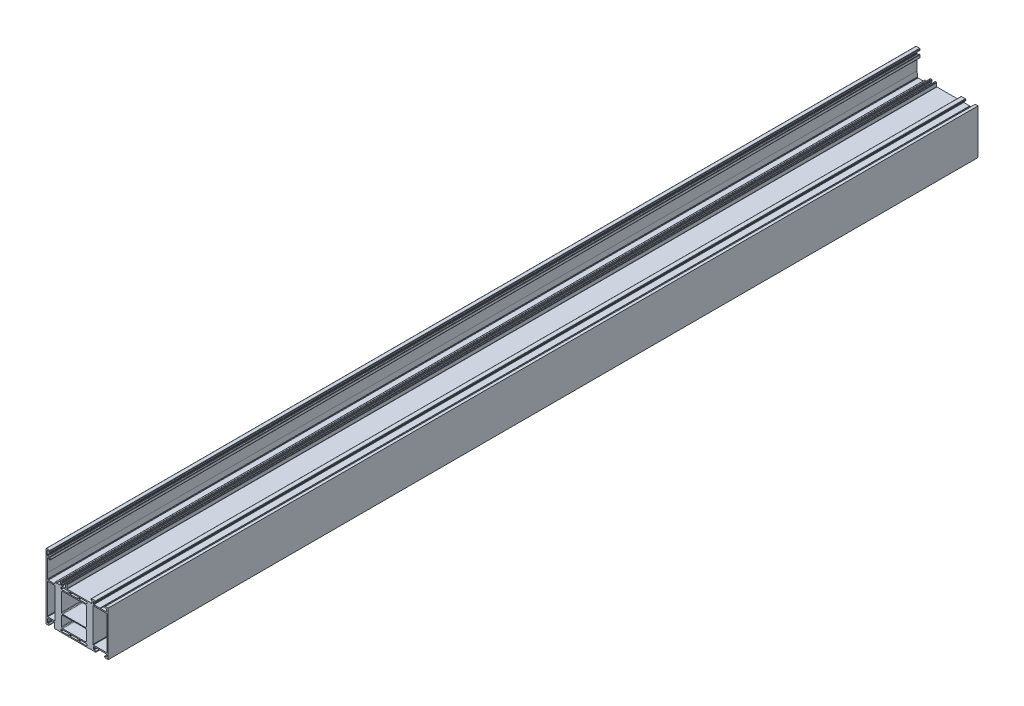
SolidWorks part; units mm, degrees
ref_plane "Ebene vorne" through (0, 0, 0) normal (0, 0, 1) x (1, 0, 0)
ref_plane "Ebene oben" through (0, 0, 0) normal (0, 1, 0) x (1, 0, 0)
ref_plane "Ebene rechts" through (0, 0, 0) normal (1, 0, 0) x (0, 0, -1)
sketch "Skizze1" plane through (0, 0, 0) normal (0, 0, 1) x (1, 0, 0)
  line L0 (15.4, 49) -> (16.2002, 49.0012)
  line L5 (1.85, 45.533) -> (1.9706, 45.583)
  line L6 (28.9408, 47.4176) -> (28.9038, 47.3119)
  line L7 (25.3003, 49.0607) -> (25.3415, 49.0285)
  line L8 (25.3415, 49.0285) -> (25.3896, 49.0079)
  line L9 (25.3896, 49.0079) -> (25.4414, 49.0001)
  line L10 (18.5413, 47.7007) -> (18.43, 47.6881)
  line L11 (47.2413, 44.1006) -> (20.2413, 44.1006)
  line L12 (20.2413, 44.1006) -> (19.9075, 44.063)
  line L13 (19.9075, 44.063) -> (19.5905, 43.9521)
  line L14 (19.5905, 43.9521) -> (19.3061, 43.7734)
  line L15 (19.3061, 43.7734) -> (19.0685, 43.5359)
  line L16 (19.0685, 43.5359) -> (18.8898, 43.2515)
  line L17 (18.8898, 43.2515) -> (18.7789, 42.9344)
  line L18 (18.7789, 42.9344) -> (18.7413, 42.6006)
  line L19 (18.7413, 42.6006) -> (18.7413, 21.6006)
  line L20 (1.6, 27) -> (1.6, 8.9)
  line L21 (1.6, 8.9) -> (1.6125, 8.7888)
  line L22 (1.6125, 8.7888) -> (1.6495, 8.6831)
  line L23 (1.6495, 8.6831) -> (1.7091, 8.5883)
  line L24 (1.7091, 8.5883) -> (1.7883, 8.5091)
  line L25 (1.7883, 8.5091) -> (1.8831, 8.4495)
  line L26 (1.8831, 8.4495) -> (1.9887, 8.4125)
  line L27 (1.9887, 8.4125) -> (2.1, 8.4)
  line L28 (2.1, 8.4) -> (10.3, 8.4)
  line L29 (10.3, 8.4) -> (10.4113, 8.4125)
  line L30 (10.4113, 8.4125) -> (10.5169, 8.4495)
  line L31 (10.5169, 8.4495) -> (10.6117, 8.5091)
  line L32 (10.6117, 8.5091) -> (10.6909, 8.5883)
  line L33 (10.6909, 8.5883) -> (10.7505, 8.6831)
  line L34 (10.7505, 8.6831) -> (10.7875, 8.7888)
  line L35 (10.7875, 8.7888) -> (10.8, 8.9)
  line L36 (10.8, 8.9) -> (10.8, 45.1)
  line L37 (10.8, 45.1) -> (10.7875, 45.2113)
  line L38 (10.7875, 45.2113) -> (10.7505, 45.317)
  line L39 (10.7505, 45.317) -> (10.6909, 45.4118)
  line L40 (10.6909, 45.4118) -> (10.6117, 45.4909)
  line L41 (10.6117, 45.4909) -> (10.5169, 45.5505)
  line L42 (10.5169, 45.5505) -> (10.4113, 45.5875)
  line L43 (10.4113, 45.5875) -> (10.3, 45.6)
  line L44 (10.3, 45.6) -> (2.1, 45.6)
  line L45 (2.1, 45.6) -> (1.9706, 45.583)
  line L46 (1.9706, 45.583) -> (1.85, 45.533)
  line L47 (1.85, 45.533) -> (1.7465, 45.4536)
  line L48 (1.7465, 45.4536) -> (1.667, 45.35)
  line L49 (1.667, 45.35) -> (1.617, 45.2294)
  line L50 (1.617, 45.2294) -> (1.6, 45.1)
  line L51 (1.6, 45.1) -> (1.6, 27)
  line L52 (0, 0) -> (0, 39.25)
  line L53 (0, 39.25) -> (0, 78.5)
  line L54 (0, 78.5) -> (0.0125, 78.6113)
  line L55 (0.0125, 78.6113) -> (0.0495, 78.7169)
  line L56 (0.0495, 78.7169) -> (0.1091, 78.8117)
  line L57 (0.1091, 78.8117) -> (0.1883, 78.8909)
  line L58 (0.1883, 78.8909) -> (0.2831, 78.9505)
  line L59 (0.2831, 78.9505) -> (0.3887, 78.9875)
  line L60 (0.3887, 78.9875) -> (0.5, 79)
  line L61 (0.5, 79) -> (4.5, 79)
  line L62 (4.5, 79) -> (4.6113, 78.9875)
  line L63 (4.6113, 78.9875) -> (4.7169, 78.9505)
  line L64 (4.7169, 78.9505) -> (4.8117, 78.8909)
  line L65 (4.8117, 78.8909) -> (4.8909, 78.8117)
  line L66 (4.8909, 78.8117) -> (4.9505, 78.7169)
  line L67 (4.9505, 78.7169) -> (4.9875, 78.6113)
  line L68 (4.9875, 78.6113) -> (5, 78.5)
  line L69 (5, 78.5) -> (5, 77.2)
  line L70 (5, 77.2) -> (4.9875, 77.0887)
  line L71 (4.9875, 77.0887) -> (4.9505, 76.983)
  line L72 (4.9505, 76.983) -> (4.8909, 76.8882)
  line L73 (4.8909, 76.8882) -> (4.8117, 76.8091)
  line L74 (4.8117, 76.8091) -> (4.7169, 76.7495)
  line L75 (4.7169, 76.7495) -> (4.6113, 76.7125)
  line L76 (4.6113, 76.7125) -> (4.5, 76.7)
  line L77 (4.5, 76.7) -> (4, 76.7)
  line L78 (4, 76.7) -> (4, 77.7)
  line L79 (4, 77.7) -> (2.3, 77.7)
  line L80 (2.3, 77.7) -> (2.0412, 77.6659)
  line L81 (2.0412, 77.6659) -> (1.8, 77.566)
  line L82 (1.8, 77.566) -> (1.5929, 77.4071)
  line L83 (1.5929, 77.4071) -> (1.434, 77.2)
  line L84 (1.434, 77.2) -> (1.3341, 76.9588)
  line L85 (1.3341, 76.9588) -> (1.3, 76.7)
  line L86 (1.3, 76.7) -> (1.3, 72.7)
  line L87 (1.3, 72.7) -> (1.3251, 72.4775)
  line L88 (1.3251, 72.4775) -> (1.399, 72.2661)
  line L89 (1.399, 72.2661) -> (1.5182, 72.0765)
  line L90 (1.5182, 72.0765) -> (1.6765, 71.9182)
  line L91 (1.6765, 71.9182) -> (1.8661, 71.799)
  line L92 (1.8661, 71.799) -> (2.0775, 71.7251)
  line L93 (2.0775, 71.7251) -> (2.3, 71.7)
  line L94 (2.3, 71.7) -> (4, 71.7)
  line L95 (4, 71.7) -> (4, 72.7)
  line L96 (4, 72.7) -> (4.5, 72.7)
  line L97 (4.5, 72.7) -> (4.6294, 72.683)
  line L98 (4.6294, 72.683) -> (4.75, 72.633)
  line L99 (4.75, 72.633) -> (4.8535, 72.5536)
  line L100 (4.8535, 72.5536) -> (4.933, 72.45)
  line L101 (4.933, 72.45) -> (4.983, 72.3294)
  line L102 (4.983, 72.3294) -> (5, 72.2)
  line L103 (5, 72.2) -> (5, 69.4)
  line L104 (5, 69.4) -> (4.9875, 69.2887)
  line L105 (4.9875, 69.2887) -> (4.9505, 69.1831)
  line L106 (4.9505, 69.1831) -> (4.8909, 69.0882)
  line L107 (4.8909, 69.0882) -> (4.8117, 69.0091)
  line L108 (4.8117, 69.0091) -> (4.7169, 68.9495)
  line L109 (4.7169, 68.9495) -> (4.6113, 68.9125)
  line L110 (4.6113, 68.9125) -> (4.5, 68.9)
  line L111 (4.5, 68.9) -> (4.3, 68.9)
  line L112 (4.3, 68.9) -> (4.1887, 68.9125)
  line L113 (4.1887, 68.9125) -> (4.0831, 68.9495)
  line L114 (4.0831, 68.9495) -> (3.9883, 69.0091)
  line L115 (3.9883, 69.0091) -> (3.9091, 69.0882)
  line L116 (3.9091, 69.0882) -> (3.8495, 69.1831)
  line L117 (3.8495, 69.1831) -> (3.8125, 69.2887)
  line L118 (3.8125, 69.2887) -> (3.8, 69.4)
  line L119 (3.8, 69.4) -> (3.8, 69.9)
  line L120 (3.8, 69.9) -> (3.783, 70.0294)
  line L121 (3.783, 70.0294) -> (3.733, 70.15)
  line L122 (3.733, 70.15) -> (3.6536, 70.2535)
  line L123 (3.6536, 70.2535) -> (3.55, 70.333)
  line L124 (3.55, 70.333) -> (3.4294, 70.383)
  line L125 (3.4294, 70.383) -> (3.3, 70.4)
  line L126 (3.3, 70.4) -> (2.1, 70.4)
  line L127 (2.1, 70.4) -> (1.9887, 70.3875)
  line L128 (1.9887, 70.3875) -> (1.8831, 70.3505)
  line L129 (1.8831, 70.3505) -> (1.7883, 70.2909)
  line L130 (1.7883, 70.2909) -> (1.7091, 70.2117)
  line L131 (1.7091, 70.2117) -> (1.6495, 70.1169)
  line L132 (1.6495, 70.1169) -> (1.6125, 70.0113)
  line L133 (1.6125, 70.0113) -> (1.6, 69.9)
  line L134 (1.6, 69.9) -> (1.6, 54)
  line L135 (1.6, 54) -> (1.9461, 47.943)
  line L136 (1.9461, 47.943) -> (1.992, 47.6956)
  line L137 (1.992, 47.6956) -> (2.0981, 47.4674)
  line L138 (2.0981, 47.4674) -> (2.2578, 47.273)
  line L139 (2.2578, 47.273) -> (2.461, 47.1246)
  line L140 (2.461, 47.1246) -> (2.6949, 47.0317)
  line L141 (2.6949, 47.0317) -> (2.9445, 47)
  line L142 (2.9445, 47) -> (10.1, 47)
  line L143 (10.1, 47) -> (10.2294, 47.017)
  line L144 (10.2294, 47.017) -> (10.35, 47.067)
  line L145 (10.35, 47.067) -> (10.4536, 47.1464)
  line L146 (10.4536, 47.1464) -> (10.533, 47.25)
  line L147 (10.533, 47.25) -> (10.583, 47.3706)
  line L148 (10.583, 47.3706) -> (10.6, 47.5)
  line L149 (10.6, 47.5) -> (10.6, 48.5)
  line L150 (10.6, 48.5) -> (10.6125, 48.6113)
  line L151 (10.6125, 48.6113) -> (10.6495, 48.7169)
  line L152 (10.6495, 48.7169) -> (10.7091, 48.8117)
  line L153 (10.7091, 48.8117) -> (10.7883, 48.8909)
  line L154 (10.7883, 48.8909) -> (10.8831, 48.9505)
  line L155 (10.8831, 48.9505) -> (10.9887, 48.9875)
  line L156 (10.9887, 48.9875) -> (11.1, 49)
  line L157 (11.1, 49) -> (12.5, 49)
  line L158 (12.5, 49) -> (12.5294, 48.9337)
  line L159 (12.5294, 48.9337) -> (12.5749, 48.8772)
  line L160 (12.5749, 48.8772) -> (12.6335, 48.8343)
  line L161 (12.6335, 48.8343) -> (12.7011, 48.808)
  line L162 (12.7011, 48.808) -> (12.7732, 48.8)
  line L163 (12.7732, 48.8) -> (13.2268, 48.8)
  line L164 (13.2268, 48.8) -> (13.2989, 48.808)
  line L165 (13.2989, 48.808) -> (13.3665, 48.8343)
  line L166 (13.3665, 48.8343) -> (13.4251, 48.8772)
  line L167 (13.4251, 48.8772) -> (13.4706, 48.9337)
  line L168 (13.4706, 48.9337) -> (13.5, 49)
  line L169 (13.5, 49) -> (15.4, 49)
  line L273 (15.3998, 0.1999) -> (13.4999, 0.1999)
  line L274 (13.4999, 0.1999) -> (13.4705, 0.2662)
  line L275 (13.4705, 0.2662) -> (13.4249, 0.3227)
  line L276 (13.4249, 0.3227) -> (13.3664, 0.3656)
  line L277 (13.3664, 0.3656) -> (13.2988, 0.3919)
  line L278 (13.2988, 0.3919) -> (13.2266, 0.3999)
  line L279 (13.2266, 0.3999) -> (12.7731, 0.3999)
  line L280 (12.7731, 0.3999) -> (12.701, 0.3919)
  line L281 (12.701, 0.3919) -> (12.6334, 0.3656)
  line L282 (12.6334, 0.3656) -> (12.5749, 0.3228)
  line L283 (12.5749, 0.3228) -> (12.5295, 0.2663)
  line L284 (12.5295, 0.2663) -> (12.5001, 0.2)
  line L285 (12.5001, 0.2) -> (11, 0.2)
  line L286 (11, 0.2) -> (10.8887, 0.2125)
  line L287 (10.8887, 0.2125) -> (10.7831, 0.2495)
  line L288 (10.7831, 0.2495) -> (10.6883, 0.3091)
  line L289 (10.6883, 0.3091) -> (10.6091, 0.3883)
  line L290 (10.6091, 0.3883) -> (10.5495, 0.4831)
  line L291 (10.5495, 0.4831) -> (10.5125, 0.5888)
  line L292 (10.5125, 0.5888) -> (10.5, 0.7)
  line L293 (10.5, 0.7) -> (10.5, 6.5)
  line L294 (10.5, 6.5) -> (10.4875, 6.6113)
  line L295 (10.4875, 6.6113) -> (10.4505, 6.7169)
  line L296 (10.4505, 6.7169) -> (10.3909, 6.8117)
  line L297 (10.3909, 6.8117) -> (10.3117, 6.8909)
  line L298 (10.3117, 6.8909) -> (10.2169, 6.9505)
  line L299 (10.2169, 6.9505) -> (10.1113, 6.9875)
  line L300 (10.1113, 6.9875) -> (10, 7)
  line L301 (10, 7) -> (2.8, 7)
  line L302 (2.8, 7) -> (2.5412, 6.9659)
  line L303 (2.5412, 6.9659) -> (2.3, 6.866)
  line L304 (2.3, 6.866) -> (2.0929, 6.7071)
  line L305 (2.0929, 6.7071) -> (1.934, 6.5)
  line L306 (1.934, 6.5) -> (1.8341, 6.2588)
  line L307 (1.8341, 6.2588) -> (1.8, 6)
  line L308 (1.8, 6) -> (1.8, 2.7)
  line L309 (1.8, 2.7) -> (1.8251, 2.4775)
  line L310 (1.8251, 2.4775) -> (1.899, 2.2661)
  line L311 (1.899, 2.2661) -> (2.0182, 2.0765)
  line L312 (2.0182, 2.0765) -> (2.1765, 1.9182)
  line L313 (2.1765, 1.9182) -> (2.3661, 1.799)
  line L314 (2.3661, 1.799) -> (2.5775, 1.7251)
  line L315 (2.5775, 1.7251) -> (2.8, 1.7)
  line L316 (2.8, 1.7) -> (4.5, 1.7)
  line L317 (4.5, 1.7) -> (4.5, 1.1)
  line L318 (4.5, 1.1) -> (3.4, 0)
  line L319 (3.4, 0) -> (0, 0)
  line L320 (29.04, 45.5493) -> (29.0795, 45.5097)
  line L321 (29.0795, 45.5097) -> (29.1743, 45.4502)
  line L322 (29.1743, 45.4502) -> (29.28, 45.4132)
  line L323 (29.28, 45.4132) -> (29.3913, 45.4006)
  line L324 (29.3913, 45.4006) -> (38.0913, 45.4006)
  line L325 (38.0913, 45.4006) -> (38.2207, 45.4177)
  line L326 (38.2207, 45.4177) -> (38.3413, 45.4676)
  line L327 (38.3413, 45.4676) -> (38.4448, 45.5471)
  line L328 (38.4448, 45.5471) -> (38.5243, 45.6506)
  line L329 (38.5243, 45.6506) -> (38.5743, 45.7712)
  line L330 (38.5743, 45.7712) -> (38.5913, 45.9006)
  line L331 (38.5913, 45.9006) -> (38.5913, 47.2007)
  line L332 (38.5913, 47.2007) -> (38.5788, 47.3119)
  line L333 (38.5788, 47.3119) -> (38.5418, 47.4176)
  line L334 (38.5418, 47.4176) -> (38.4822, 47.5124)
  line L335 (38.4822, 47.5124) -> (38.403, 47.5916)
  line L336 (38.403, 47.5916) -> (38.3082, 47.6511)
  line L337 (38.3082, 47.6511) -> (38.2026, 47.6881)
  line L338 (38.2026, 47.6881) -> (38.0913, 47.7007)
  line L339 (38.0913, 47.7007) -> (29.3913, 47.7007)
  line L340 (29.3913, 47.7007) -> (29.28, 47.6881)
  line L341 (29.28, 47.6881) -> (29.1743, 47.6511)
  line L342 (29.1743, 47.6511) -> (29.0795, 47.5916)
  line L343 (29.0795, 47.5916) -> (29.0004, 47.5124)
  line L344 (29.0004, 47.5124) -> (28.9408, 47.4176)
  line L345 (28.9408, 47.4176) -> (28.9038, 47.3119)
  line L346 (28.9038, 47.3119) -> (28.8913, 47.2007)
  line L347 (28.8913, 47.2007) -> (28.8913, 45.9006)
  line L348 (28.8913, 45.9006) -> (28.9038, 45.7894)
  line L349 (28.9038, 45.7894) -> (28.9408, 45.6837)
  line L350 (28.9408, 45.6837) -> (29.0004, 45.5889)
  line L351 (29.0004, 45.5889) -> (29.04, 45.5493)
  line L352 (22.9663, 47.7007) -> (18.5413, 47.7007)
  line L353 (18.5413, 47.7007) -> (18.43, 47.6881)
  line L354 (18.43, 47.6881) -> (18.3243, 47.6511)
  line L355 (18.3243, 47.6511) -> (18.2295, 47.5916)
  line L356 (18.2295, 47.5916) -> (18.1504, 47.5124)
  line L357 (18.1504, 47.5124) -> (18.0908, 47.4176)
  line L358 (18.0908, 47.4176) -> (18.0538, 47.3119)
  line L359 (18.0538, 47.3119) -> (18.0413, 47.2007)
  line L360 (18.0413, 47.2007) -> (18.0413, 45.9007)
  line L361 (18.0413, 45.9007) -> (18.0538, 45.7894)
  line L362 (18.0538, 45.7894) -> (18.0908, 45.6837)
  line L363 (18.0908, 45.6837) -> (18.1504, 45.5889)
  line L364 (18.1504, 45.5889) -> (18.2296, 45.5097)
  line L365 (18.2296, 45.5097) -> (18.3244, 45.4502)
  line L366 (18.3244, 45.4502) -> (18.43, 45.4132)
  line L367 (18.43, 45.4132) -> (18.5413, 45.4006)
  line L368 (18.5413, 45.4006) -> (27.3913, 45.4006)
  line L369 (27.3913, 45.4006) -> (27.4469, 45.4069)
  line L370 (27.4469, 45.4069) -> (27.5025, 45.4132)
  line L371 (27.5025, 45.4132) -> (27.6082, 45.4502)
  line L372 (27.6082, 45.4502) -> (27.703, 45.5097)
  line L373 (27.703, 45.5097) -> (27.7822, 45.5889)
  line L374 (27.7822, 45.5889) -> (27.8418, 45.6837)
  line L375 (27.8418, 45.6837) -> (27.8788, 45.7894)
  line L376 (27.8788, 45.7894) -> (27.8913, 45.9006)
  line L377 (27.8913, 45.9006) -> (27.8913, 47.2006)
  line L378 (27.8913, 47.2006) -> (27.8788, 47.3119)
  line L379 (27.8788, 47.3119) -> (27.8418, 47.4176)
  line L380 (27.8418, 47.4176) -> (27.7822, 47.5124)
  line L381 (27.7822, 47.5124) -> (27.703, 47.5916)
  line L382 (27.703, 47.5916) -> (27.6082, 47.6511)
  line L383 (27.6082, 47.6511) -> (27.5026, 47.6881)
  line L384 (27.5026, 47.6881) -> (27.3913, 47.7007)
  line L385 (27.3913, 47.7007) -> (22.9663, 47.7007)
  line L386 (25.4414, 49.0001) -> (38.362, 49.0001)
  line L387 (38.362, 49.0001) -> (44.8224, 49.0001)
  line L388 (44.8224, 49.0001) -> (52.1201, 49.0001)
  line L424 (47.2451, 44.1002) -> (33.7413, 44.1006)
  line L460 (16.2002, 49.0012) -> (17.0413, 49.0025)
  line L461 (17.0413, 49.0025) -> (17.0858, 49.0075)
  line L462 (17.0858, 49.0075) -> (17.1281, 49.0223)
  line L463 (17.1281, 49.0223) -> (17.166, 49.0462)
  line L464 (17.166, 49.0462) -> (17.1977, 49.0778)
  line L465 (17.1977, 49.0778) -> (17.2215, 49.1158)
  line L466 (17.2215, 49.1158) -> (17.2363, 49.158)
  line L467 (17.2363, 49.158) -> (17.2413, 49.2025)
  line L468 (17.2413, 49.2025) -> (17.2413, 53.3025)
  line L469 (17.2413, 53.3025) -> (17.2538, 53.4138)
  line L470 (17.2538, 53.4138) -> (17.2908, 53.5195)
  line L471 (17.2908, 53.5195) -> (17.3504, 53.6143)
  line L472 (17.3504, 53.6143) -> (17.4296, 53.6935)
  line L473 (17.4296, 53.6935) -> (17.5244, 53.753)
  line L474 (17.5244, 53.753) -> (17.63, 53.79)
  line L475 (17.63, 53.79) -> (17.7413, 53.8025)
  line L476 (17.7413, 53.8025) -> (18.572, 53.8025)
  line L477 (18.572, 53.8025) -> (18.8309, 53.7685)
  line L478 (18.8309, 53.7685) -> (19.072, 53.6686)
  line L479 (19.072, 53.6686) -> (19.2792, 53.5096)
  line L480 (19.2792, 53.5096) -> (19.4381, 53.3025)
  line L481 (19.4381, 53.3025) -> (19.538, 53.0614)
  line L482 (19.538, 53.0614) -> (19.7413, 52.3025)
  line L483 (19.7413, 52.3025) -> (18.7413, 52.3025)
  line L484 (18.7413, 52.3025) -> (18.7413, 50.0025)
  line L485 (18.7413, 50.0025) -> (18.7757, 49.7436)
  line L486 (18.7757, 49.7436) -> (18.8757, 49.5024)
  line L487 (18.8757, 49.5024) -> (19.0346, 49.2951)
  line L488 (19.0346, 49.2951) -> (19.2415, 49.1357)
  line L489 (19.2415, 49.1357) -> (19.4825, 49.0351)
  line L490 (19.4825, 49.0351) -> (19.7413, 49.0001)
  line L491 (19.7413, 49.0001) -> (22.7412, 49.0001)
  line L492 (22.7412, 49.0001) -> (23, 49.0351)
  line L493 (23, 49.0351) -> (23.2411, 49.1357)
  line L494 (23.2411, 49.1357) -> (23.448, 49.295)
  line L495 (23.448, 49.295) -> (23.6069, 49.5024)
  line L496 (23.6069, 49.5024) -> (23.7069, 49.7436)
  line L497 (23.7069, 49.7436) -> (23.7413, 50.0025)
  line L498 (23.7413, 50.0025) -> (23.7413, 52.3025)
  line L499 (23.7413, 52.3025) -> (22.7413, 52.3025)
  line L500 (22.7413, 52.3025) -> (22.9446, 53.0614)
  line L501 (22.9446, 53.0614) -> (23.0445, 53.3025)
  line L502 (23.0445, 53.3025) -> (23.2034, 53.5096)
  line L503 (23.2034, 53.5096) -> (23.4105, 53.6686)
  line L504 (23.4105, 53.6686) -> (23.6517, 53.7685)
  line L505 (23.6517, 53.7685) -> (23.9105, 53.8025)
  line L506 (23.9105, 53.8025) -> (24.7413, 53.8025)
  line L507 (24.7413, 53.8025) -> (24.8526, 53.79)
  line L508 (24.8526, 53.79) -> (24.9582, 53.753)
  line L509 (24.9582, 53.753) -> (25.053, 53.6934)
  line L510 (25.053, 53.6934) -> (25.1322, 53.6143)
  line L511 (25.1322, 53.6143) -> (25.1918, 53.5195)
  line L512 (25.1918, 53.5195) -> (25.2288, 53.4138)
  line L513 (25.2288, 53.4138) -> (25.2413, 53.3025)
  line L514 (25.2413, 53.3025) -> (25.2413, 49.2025)
  line L515 (25.2413, 49.2025) -> (25.2484, 49.1507)
  line L516 (25.2484, 49.1507) -> (25.2685, 49.1024)
  line L517 (25.2685, 49.1024) -> (25.3003, 49.0607)
  line L518 (25.3003, 49.0607) -> (25.4414, 49.0001)
  line L519 (48.7414, 17.5996) -> (48.7414, 6.5996)
  line L520 (48.7414, 6.5996) -> (48.7038, 6.2658)
  line L521 (48.7038, 6.2658) -> (48.5929, 5.9487)
  line L522 (48.5929, 5.9487) -> (48.4142, 5.6643)
  line L523 (48.4142, 5.6643) -> (48.1766, 5.4268)
  line L524 (48.1766, 5.4268) -> (47.8922, 5.2481)
  line L525 (47.8922, 5.2481) -> (47.5752, 5.1372)
  line L526 (47.5752, 5.1372) -> (47.2414, 5.0996)
  line L527 (47.2414, 5.0996) -> (20.2414, 5.0996)
  line L528 (20.2414, 5.0996) -> (19.9076, 5.1372)
  line L529 (19.9076, 5.1372) -> (19.5906, 5.2481)
  line L530 (19.5906, 5.2481) -> (19.3062, 5.4268)
  line L531 (19.3062, 5.4268) -> (19.0687, 5.6643)
  line L532 (19.0687, 5.6643) -> (18.89, 5.9487)
  line L533 (18.89, 5.9487) -> (18.779, 6.2658)
  line L534 (18.779, 6.2658) -> (18.7414, 6.5996)
  line L535 (18.7414, 6.5996) -> (18.7414, 17.5996)
  line L536 (18.7414, 17.5996) -> (18.779, 17.9334)
  line L537 (18.779, 17.9334) -> (18.89, 18.2504)
  line L538 (18.89, 18.2504) -> (19.0687, 18.5348)
  line L539 (19.0687, 18.5348) -> (19.3062, 18.7723)
  line L540 (19.3062, 18.7723) -> (19.5906, 18.951)
  line L541 (19.5906, 18.951) -> (19.9076, 19.062)
  line L542 (19.9076, 19.062) -> (20.2414, 19.0996)
  line L543 (20.2414, 19.0996) -> (47.2414, 19.0996)
  line L544 (47.2414, 19.0996) -> (47.5752, 19.062)
  line L545 (47.5752, 19.062) -> (47.8922, 18.951)
  line L546 (47.8922, 18.951) -> (48.1766, 18.7723)
  line L547 (48.1766, 18.7723) -> (48.4142, 18.5348)
  line L548 (48.4142, 18.5348) -> (48.5929, 18.2504)
  line L549 (48.5929, 18.2504) -> (48.7038, 17.9334)
  line L550 (48.7038, 17.9334) -> (48.7414, 17.5996)
  line L551 (38.3084, 3.75) -> (38.2027, 3.787)
  line L553 (27.6084, 3.75) -> (27.5027, 3.787)
  line L554 (39.6408, 47.4176) -> (39.6038, 47.3119)
  line L555 (47.5751, 44.063) -> (47.2413, 44.1006)
  line L556 (18.7413, 21.6006) -> (18.7789, 21.2669)
  line L557 (18.7789, 21.2669) -> (18.8898, 20.9498)
  line L558 (18.8898, 20.9498) -> (19.0685, 20.6654)
  line L559 (19.0685, 20.6654) -> (19.3061, 20.4279)
  line L560 (19.3061, 20.4279) -> (19.5905, 20.2492)
  line L561 (19.5905, 20.2492) -> (19.9075, 20.1382)
  line L562 (19.9075, 20.1382) -> (20.2413, 20.1006)
  line L563 (20.2413, 20.1006) -> (47.2413, 20.1006)
  line L564 (47.2413, 20.1006) -> (47.5751, 20.1382)
  line L565 (47.5751, 20.1382) -> (47.8921, 20.2492)
  line L566 (47.8921, 20.2492) -> (48.1765, 20.4279)
  line L567 (48.1765, 20.4279) -> (48.414, 20.6654)
  line L568 (48.414, 20.6654) -> (48.5927, 20.9498)
  line L569 (48.5927, 20.9498) -> (48.7037, 21.2669)
  line L570 (48.7037, 21.2669) -> (48.7413, 21.6006)
  line L571 (48.7413, 21.6006) -> (48.7413, 42.6006)
  line L572 (48.7413, 42.6006) -> (48.7037, 42.9344)
  line L573 (48.7037, 42.9344) -> (48.5927, 43.2515)
  line L574 (48.5927, 43.2515) -> (48.414, 43.5359)
  line L575 (48.414, 43.5359) -> (48.1765, 43.7734)
  line L576 (48.1765, 43.7734) -> (47.8921, 43.9521)
  line L577 (47.8921, 43.9521) -> (47.5751, 44.063)
  line L578 (73.3998, 27) -> (73.3998, 47)
  line L579 (73.3998, 47) -> (73.3828, 47.1294)
  line L580 (73.3828, 47.1294) -> (73.3328, 47.25)
  line L581 (73.3328, 47.25) -> (73.2534, 47.3535)
  line L582 (73.2534, 47.3535) -> (73.1498, 47.433)
  line L583 (73.1498, 47.433) -> (73.0292, 47.4829)
  line L584 (73.0292, 47.4829) -> (72.8998, 47.5)
  line L585 (72.8998, 47.5) -> (57.1998, 47.5)
  line L586 (57.1998, 47.5) -> (57.0704, 47.4829)
  line L587 (57.0704, 47.4829) -> (56.9498, 47.433)
  line L588 (56.9498, 47.433) -> (56.8463, 47.3535)
  line L589 (56.8463, 47.3535) -> (56.7668, 47.25)
  line L590 (56.7668, 47.25) -> (56.7169, 47.1294)
  line L591 (56.7169, 47.1294) -> (56.6998, 47)
  line L592 (56.6998, 47) -> (56.6998, 7.0001)
  line L593 (56.6998, 7.0001) -> (56.7169, 6.8707)
  line L594 (56.7169, 6.8707) -> (56.7668, 6.7501)
  line L595 (56.7668, 6.7501) -> (56.8463, 6.6465)
  line L596 (56.8463, 6.6465) -> (56.9498, 6.5671)
  line L597 (56.9498, 6.5671) -> (57.0704, 6.5171)
  line L598 (57.0704, 6.5171) -> (57.1998, 6.5001)
  line L599 (57.1998, 6.5001) -> (72.8998, 6.5001)
  line L600 (72.8998, 6.5001) -> (73.0292, 6.5171)
  line L601 (73.0292, 6.5171) -> (73.1498, 6.5671)
  line L602 (73.1498, 6.5671) -> (73.2534, 6.6465)
  line L603 (73.2534, 6.6465) -> (73.3328, 6.7501)
  line L604 (73.3328, 6.7501) -> (73.3828, 6.8707)
  line L605 (73.3828, 6.8707) -> (73.3998, 7.0001)
  line L606 (73.3998, 7.0001) -> (73.3998, 27)
  line L607 (74.9998, 54) -> (74.9998, 27)
  line L608 (74.9998, 27) -> (74.9998, 0.0001)
  line L609 (74.9998, 0.0001) -> (71.5998, 0.0001)
  line L610 (71.5998, 0.0001) -> (70.4998, 1.1001)
  line L611 (70.4998, 1.1001) -> (70.4998, 1.7001)
  line L612 (70.4998, 1.7001) -> (72.2998, 1.7001)
  line L613 (72.2998, 1.7001) -> (72.5587, 1.7342)
  line L614 (72.5587, 1.7342) -> (72.7998, 1.8341)
  line L615 (72.7998, 1.8341) -> (73.0069, 1.993)
  line L616 (73.0069, 1.993) -> (73.1658, 2.2001)
  line L617 (73.1658, 2.2001) -> (73.2658, 2.4413)
  line L618 (73.2658, 2.4413) -> (73.2998, 2.7001)
  line L619 (73.2998, 2.7001) -> (73.2998, 4.0001)
  line L620 (73.2998, 4.0001) -> (73.2658, 4.2589)
  line L621 (73.2658, 4.2589) -> (73.1659, 4.5001)
  line L622 (73.1659, 4.5001) -> (73.0069, 4.7072)
  line L623 (73.0069, 4.7072) -> (72.7998, 4.8661)
  line L624 (72.7998, 4.8661) -> (72.5587, 4.966)
  line L625 (72.5587, 4.966) -> (72.2998, 5.0001)
  line L626 (72.2998, 5.0001) -> (65.9998, 5.0001)
  line L627 (65.9998, 5.0001) -> (65.8521, 5.1088)
  line L628 (65.8521, 5.1088) -> (65.6818, 5.1769)
  line L629 (65.6818, 5.1769) -> (65.4998, 5.2001)
  line L630 (65.4998, 5.2001) -> (65.3179, 5.1769)
  line L631 (65.3179, 5.1769) -> (65.1476, 5.1088)
  line L632 (65.1476, 5.1088) -> (64.9998, 5.0001)
  line L633 (64.9998, 5.0001) -> (57.9998, 5.0001)
  line L634 (57.9998, 5.0001) -> (57.7773, 4.975)
  line L635 (57.7773, 4.975) -> (57.5659, 4.901)
  line L636 (57.5659, 4.901) -> (57.3763, 4.7819)
  line L637 (57.3763, 4.7819) -> (57.218, 4.6236)
  line L638 (57.218, 4.6236) -> (57.0988, 4.434)
  line L639 (57.0988, 4.434) -> (57.0249, 4.2226)
  line L640 (57.0249, 4.2226) -> (56.9998, 4.0001)
  line L641 (56.9998, 4.0001) -> (56.9998, 2.7001)
  line L642 (56.9998, 2.7001) -> (57.0339, 2.4413)
  line L643 (57.0339, 2.4413) -> (57.1338, 2.2001)
  line L644 (57.1338, 2.2001) -> (57.2927, 1.993)
  line L645 (57.2927, 1.993) -> (57.4998, 1.8341)
  line L646 (57.4998, 1.8341) -> (57.741, 1.7342)
  line L647 (57.741, 1.7342) -> (57.9998, 1.7001)
  line L648 (57.9998, 1.7001) -> (60.4998, 1.7001)
  line L649 (60.4998, 1.7001) -> (60.4998, 1.2001)
  line L650 (60.4998, 1.2001) -> (60.4657, 0.9413)
  line L651 (60.4657, 0.9413) -> (60.3658, 0.7001)
  line L652 (60.3658, 0.7001) -> (60.2069, 0.493)
  line L653 (60.2069, 0.493) -> (59.9998, 0.3341)
  line L654 (59.9998, 0.3341) -> (59.7586, 0.2342)
  line L655 (59.7586, 0.2342) -> (59.4998, 0.2001)
  line L656 (59.4998, 0.2001) -> (55.0001, 0.2001)
  line L657 (55.0001, 0.2001) -> (54.9708, 0.2664)
  line L658 (54.9708, 0.2664) -> (54.9252, 0.3229)
  line L659 (54.9252, 0.3229) -> (54.8667, 0.3658)
  line L660 (54.8667, 0.3658) -> (54.7991, 0.3921)
  line L661 (54.7991, 0.3921) -> (54.727, 0.4001)
  line L662 (54.727, 0.4001) -> (54.2734, 0.4001)
  line L663 (54.2734, 0.4001) -> (54.2012, 0.3921)
  line L664 (54.2012, 0.3921) -> (54.1336, 0.3658)
  line L665 (54.1336, 0.3658) -> (54.0751, 0.3229)
  line L666 (54.0751, 0.3229) -> (54.0296, 0.2664)
  line L667 (54.0296, 0.2664) -> (54.0002, 0.2001)
  line L668 (54.0002, 0.2001) -> (52.1201, 0.2001)
  line L773 (52.1201, 49.0001) -> (54.0001, 49.0001)
  line L774 (54.0001, 49.0001) -> (54.0295, 48.9338)
  line L775 (54.0295, 48.9338) -> (54.075, 48.8772)
  line L776 (54.075, 48.8772) -> (54.1336, 48.8344)
  line L777 (54.1336, 48.8344) -> (54.2012, 48.8081)
  line L778 (54.2012, 48.8081) -> (54.2733, 48.8001)
  line L779 (54.2733, 48.8001) -> (54.7269, 48.8001)
  line L780 (54.7269, 48.8001) -> (54.7892, 48.8059)
  line L781 (54.7892, 48.8059) -> (54.8487, 48.8254)
  line L782 (54.8487, 48.8254) -> (54.9024, 48.8577)
  line L783 (54.9024, 48.8577) -> (54.9474, 48.9011)
  line L784 (54.9474, 48.9011) -> (54.9817, 48.9535)
  line L785 (54.9817, 48.9535) -> (55.0034, 49.0123)
  line L786 (55.0034, 49.0123) -> (55.0803, 49.0232)
  line L787 (55.0803, 49.0232) -> (55.1519, 49.0536)
  line L788 (55.1519, 49.0536) -> (55.2132, 49.1014)
  line L789 (55.2132, 49.1014) -> (55.2602, 49.1633)
  line L790 (55.2602, 49.1633) -> (55.2898, 49.2352)
  line L791 (55.2898, 49.2352) -> (55.2998, 49.3122)
  line L792 (55.2998, 49.3122) -> (55.2998, 52.3)
  line L793 (55.2998, 52.3) -> (54.4998, 52.3)
  line L794 (54.4998, 52.3) -> (54.4998, 53.3)
  line L795 (54.4998, 53.3) -> (54.5124, 53.4112)
  line L796 (54.5124, 53.4112) -> (54.5493, 53.5169)
  line L797 (54.5493, 53.5169) -> (54.6089, 53.6117)
  line L798 (54.6089, 53.6117) -> (54.6881, 53.6909)
  line L799 (54.6881, 53.6909) -> (54.7829, 53.7505)
  line L800 (54.7829, 53.7505) -> (54.8886, 53.7874)
  line L801 (54.8886, 53.7874) -> (54.9998, 53.8)
  line L802 (54.9998, 53.8) -> (59.4998, 53.8)
  line L803 (59.4998, 53.8) -> (59.7586, 53.7659)
  line L804 (59.7586, 53.7659) -> (59.9998, 53.666)
  line L805 (59.9998, 53.666) -> (60.2069, 53.5071)
  line L806 (60.2069, 53.5071) -> (60.3658, 53.3)
  line L807 (60.3658, 53.3) -> (60.4657, 53.0588)
  line L808 (60.4657, 53.0588) -> (60.4998, 52.8)
  line L809 (60.4998, 52.8) -> (60.4998, 52.3)
  line L810 (60.4998, 52.3) -> (57.9998, 52.3)
  line L811 (57.9998, 52.3) -> (57.741, 52.2659)
  line L812 (57.741, 52.2659) -> (57.4998, 52.166)
  line L813 (57.4998, 52.166) -> (57.2927, 52.0071)
  line L814 (57.2927, 52.0071) -> (57.1338, 51.8)
  line L815 (57.1338, 51.8) -> (57.0339, 51.5588)
  line L816 (57.0339, 51.5588) -> (56.9998, 51.3)
  line L817 (56.9998, 51.3) -> (56.9998, 50)
  line L818 (56.9998, 50) -> (57.0339, 49.7412)
  line L819 (57.0339, 49.7412) -> (57.1338, 49.5)
  line L820 (57.1338, 49.5) -> (57.2927, 49.2929)
  line L821 (57.2927, 49.2929) -> (57.4998, 49.134)
  line L822 (57.4998, 49.134) -> (57.741, 49.0341)
  line L823 (57.741, 49.0341) -> (57.9998, 49)
  line L824 (57.9998, 49) -> (64.9998, 49)
  line L825 (64.9998, 49) -> (65.1476, 48.8913)
  line L826 (65.1476, 48.8913) -> (65.3179, 48.8231)
  line L827 (65.3179, 48.8231) -> (65.4998, 48.7999)
  line L828 (65.4998, 48.7999) -> (65.6818, 48.8231)
  line L829 (65.6818, 48.8231) -> (65.8521, 48.8913)
  line L830 (65.8521, 48.8913) -> (65.9998, 49)
  line L831 (65.9998, 49) -> (72.0003, 49)
  line L832 (72.0003, 49) -> (72.2591, 49.0341)
  line L833 (72.2591, 49.0341) -> (72.5003, 49.134)
  line L834 (72.5003, 49.134) -> (72.7074, 49.2929)
  line L835 (72.7074, 49.2929) -> (72.8663, 49.5)
  line L836 (72.8663, 49.5) -> (72.9662, 49.7412)
  line L837 (72.9662, 49.7412) -> (73.0003, 50)
  line L838 (73.0003, 50) -> (73.0003, 51.3)
  line L839 (73.0003, 51.3) -> (72.9662, 51.5588)
  line L840 (72.9662, 51.5588) -> (72.8663, 51.8)
  line L841 (72.8663, 51.8) -> (72.7074, 52.0071)
  line L842 (72.7074, 52.0071) -> (72.5003, 52.166)
  line L843 (72.5003, 52.166) -> (72.2591, 52.2659)
  line L844 (72.2591, 52.2659) -> (72.0003, 52.3)
  line L845 (72.0003, 52.3) -> (70.4998, 52.3)
  line L846 (70.4998, 52.3) -> (70.4998, 52.9)
  line L847 (70.4998, 52.9) -> (71.5998, 54)
  line L848 (71.5998, 54) -> (74.9998, 54)
  line L849 (48.9969, 47.6944) -> (48.9413, 47.7007)
  line L850 (48.9413, 47.7007) -> (40.0913, 47.7007)
  line L851 (40.0913, 47.7007) -> (39.98, 47.6881)
  line L852 (39.98, 47.6881) -> (39.8743, 47.6511)
  line L853 (39.8743, 47.6511) -> (39.7795, 47.5916)
  line L854 (39.7795, 47.5916) -> (39.7004, 47.5124)
  line L855 (39.7004, 47.5124) -> (39.6408, 47.4176)
  line L856 (39.6408, 47.4176) -> (39.6038, 47.3119)
  line L857 (39.6038, 47.3119) -> (39.5913, 47.2006)
  line L858 (39.5913, 47.2006) -> (39.5913, 45.9006)
  line L859 (39.5913, 45.9006) -> (39.6038, 45.7894)
  line L860 (39.6038, 45.7894) -> (39.6408, 45.6837)
  line L861 (39.6408, 45.6837) -> (39.7004, 45.5889)
  line L862 (39.7004, 45.5889) -> (39.7795, 45.5097)
  line L863 (39.7795, 45.5097) -> (39.8743, 45.4502)
  line L864 (39.8743, 45.4502) -> (39.98, 45.4132)
  line L865 (39.98, 45.4132) -> (40.0913, 45.4006)
  line L866 (40.0913, 45.4006) -> (48.9413, 45.4006)
  line L867 (48.9413, 45.4006) -> (49.0525, 45.4132)
  line L868 (49.0525, 45.4132) -> (49.1582, 45.4502)
  line L869 (49.1582, 45.4502) -> (49.253, 45.5097)
  line L870 (49.253, 45.5097) -> (49.3322, 45.5889)
  line L871 (49.3322, 45.5889) -> (49.3918, 45.6837)
  line L872 (49.3918, 45.6837) -> (49.4288, 45.7894)
  line L873 (49.4288, 45.7894) -> (49.4413, 45.9006)
  line L874 (49.4413, 45.9006) -> (49.4413, 47.2006)
  line L875 (49.4413, 47.2006) -> (49.4288, 47.3119)
  line L876 (49.4288, 47.3119) -> (49.3918, 47.4176)
  line L877 (49.3918, 47.4176) -> (49.3322, 47.5124)
  line L878 (49.3322, 47.5124) -> (49.253, 47.5916)
  line L879 (49.253, 47.5916) -> (49.1582, 47.6511)
  line L880 (49.1582, 47.6511) -> (49.0525, 47.6881)
  line L881 (49.0525, 47.6881) -> (48.9969, 47.6944)
  line L882 (38.147, 3.7933) -> (38.0914, 3.7996)
  line L883 (38.0914, 3.7996) -> (29.3914, 3.7996)
  line L884 (29.3914, 3.7996) -> (29.262, 3.7825)
  line L885 (29.262, 3.7825) -> (29.1414, 3.7326)
  line L886 (29.1414, 3.7326) -> (29.0379, 3.6531)
  line L887 (29.0379, 3.6531) -> (28.9584, 3.5496)
  line L888 (28.9584, 3.5496) -> (28.9084, 3.429)
  line L889 (28.9084, 3.429) -> (28.8914, 3.2996)
  line L890 (28.8914, 3.2996) -> (28.8914, 1.9996)
  line L891 (28.8914, 1.9996) -> (28.9039, 1.8883)
  line L892 (28.9039, 1.8883) -> (28.9409, 1.7826)
  line L893 (28.9409, 1.7826) -> (29.0005, 1.6878)
  line L894 (29.0005, 1.6878) -> (29.0797, 1.6086)
  line L895 (29.0797, 1.6086) -> (29.1745, 1.5491)
  line L896 (29.1745, 1.5491) -> (29.2801, 1.5121)
  line L897 (29.2801, 1.5121) -> (29.3914, 1.4996)
  line L898 (29.3914, 1.4996) -> (38.0914, 1.4996)
  line L899 (38.0914, 1.4996) -> (38.2027, 1.5121)
  line L900 (38.2027, 1.5121) -> (38.3084, 1.5491)
  line L901 (38.3084, 1.5491) -> (38.4032, 1.6086)
  line L902 (38.4032, 1.6086) -> (38.4823, 1.6878)
  line L903 (38.4823, 1.6878) -> (38.5419, 1.7826)
  line L904 (38.5419, 1.7826) -> (38.5789, 1.8883)
  line L905 (38.5789, 1.8883) -> (38.5914, 1.9996)
  line L906 (38.5914, 1.9996) -> (38.5914, 3.2996)
  line L907 (38.5914, 3.2996) -> (38.5789, 3.4108)
  line L908 (38.5789, 3.4108) -> (38.5419, 3.5165)
  line L909 (38.5419, 3.5165) -> (38.4823, 3.6113)
  line L910 (38.4823, 3.6113) -> (38.4032, 3.6905)
  line L911 (38.4032, 3.6905) -> (38.3084, 3.75)
  line L912 (38.3084, 3.75) -> (38.2027, 3.787)
  line L913 (38.2027, 3.787) -> (38.147, 3.7933)
  line L914 (40.0358, 1.5058) -> (40.0914, 1.4996)
  line L915 (40.0914, 1.4996) -> (48.9414, 1.4996)
  line L916 (48.9414, 1.4996) -> (49.0527, 1.5121)
  line L917 (49.0527, 1.5121) -> (49.1584, 1.5491)
  line L918 (49.1584, 1.5491) -> (49.2532, 1.6086)
  line L919 (49.2532, 1.6086) -> (49.3323, 1.6878)
  line L920 (49.3323, 1.6878) -> (49.3919, 1.7826)
  line L921 (49.3919, 1.7826) -> (49.4289, 1.8883)
  line L922 (49.4289, 1.8883) -> (49.4414, 1.9995)
  line L923 (49.4414, 1.9995) -> (49.4414, 3.2995)
  line L924 (49.4414, 3.2995) -> (49.4289, 3.4108)
  line L925 (49.4289, 3.4108) -> (49.3919, 3.5165)
  line L926 (49.3919, 3.5165) -> (49.3323, 3.6113)
  line L927 (49.3323, 3.6113) -> (49.2531, 3.6905)
  line L928 (49.2531, 3.6905) -> (49.1583, 3.75)
  line L929 (49.1583, 3.75) -> (49.0527, 3.787)
  line L930 (49.0527, 3.787) -> (48.9414, 3.7996)
  line L931 (48.9414, 3.7996) -> (40.0914, 3.7996)
  line L932 (40.0914, 3.7996) -> (40.0358, 3.7933)
  line L933 (40.0358, 3.7933) -> (39.9802, 3.787)
  line L934 (39.9802, 3.787) -> (39.8745, 3.75)
  line L935 (39.8745, 3.75) -> (39.7797, 3.6905)
  line L936 (39.7797, 3.6905) -> (39.7005, 3.6113)
  line L937 (39.7005, 3.6113) -> (39.6409, 3.5165)
  line L938 (39.6409, 3.5165) -> (39.604, 3.4108)
  line L939 (39.604, 3.4108) -> (39.5914, 3.2996)
  line L940 (39.5914, 3.2996) -> (39.5914, 1.9996)
  line L941 (39.5914, 1.9996) -> (39.6039, 1.8883)
  line L942 (39.6039, 1.8883) -> (39.6409, 1.7826)
  line L943 (39.6409, 1.7826) -> (39.7005, 1.6878)
  line L944 (39.7005, 1.6878) -> (39.7797, 1.6086)
  line L945 (39.7797, 1.6086) -> (39.8745, 1.5491)
  line L946 (39.8745, 1.5491) -> (39.9802, 1.5121)
  line L947 (39.9802, 1.5121) -> (40.0358, 1.5058)
  line L948 (18.4858, 1.5058) -> (18.5414, 1.4996)
  line L949 (18.5414, 1.4996) -> (27.3914, 1.4996)
  line L950 (27.3914, 1.4996) -> (27.5027, 1.5121)
  line L951 (27.5027, 1.5121) -> (27.6084, 1.5491)
  line L952 (27.6084, 1.5491) -> (27.7032, 1.6086)
  line L953 (27.7032, 1.6086) -> (27.7823, 1.6878)
  line L954 (27.7823, 1.6878) -> (27.8419, 1.7826)
  line L955 (27.8419, 1.7826) -> (27.8789, 1.8883)
  line L956 (27.8789, 1.8883) -> (27.8914, 1.9996)
  line L957 (27.8914, 1.9996) -> (27.8914, 3.2996)
  line L958 (27.8914, 3.2996) -> (27.8789, 3.4108)
  line L959 (27.8789, 3.4108) -> (27.8419, 3.5165)
  line L960 (27.8419, 3.5165) -> (27.7823, 3.6113)
  line L961 (27.7823, 3.6113) -> (27.7032, 3.6905)
  line L962 (27.7032, 3.6905) -> (27.6084, 3.75)
  line L963 (27.6084, 3.75) -> (27.5027, 3.787)
  line L964 (27.5027, 3.787) -> (27.3914, 3.7996)
  line L965 (27.3914, 3.7996) -> (18.5414, 3.7996)
  line L966 (18.5414, 3.7996) -> (18.4302, 3.787)
  line L967 (18.4302, 3.787) -> (18.3245, 3.75)
  line L968 (18.3245, 3.75) -> (18.2297, 3.6905)
  line L969 (18.2297, 3.6905) -> (18.1505, 3.6113)
  line L970 (18.1505, 3.6113) -> (18.0909, 3.5165)
  line L971 (18.0909, 3.5165) -> (18.0539, 3.4108)
  line L972 (18.0539, 3.4108) -> (18.0414, 3.2996)
  line L973 (18.0414, 3.2996) -> (18.0414, 1.9996)
  line L974 (18.0414, 1.9996) -> (18.0539, 1.8883)
  line L975 (18.0539, 1.8883) -> (18.0909, 1.7826)
  line L976 (18.0909, 1.7826) -> (18.1505, 1.6878)
  line L977 (18.1505, 1.6878) -> (18.2297, 1.6086)
  line L978 (18.2297, 1.6086) -> (18.3245, 1.5491)
  line L979 (18.3245, 1.5491) -> (18.4302, 1.5121)
  line L980 (18.4302, 1.5121) -> (18.4858, 1.5058)
  line L981 (52.1201, 0.2001) -> (33.7412, 0.1995)
  line L982 (33.7412, 0.1995) -> (24.9706, 0.1998)
  line L983 (24.9706, 0.1998) -> (15.3998, 0.1999)
  line L1018 (20.2376, 5.1) -> (33.7572, 5.0996)
extrude "Aufsatz-Linear austragen3" add sketch "Skizze1" along normal blind 1049 contours L983 L982 L981 L668 L667 L666 L665 L664 L663 L662 L661 L660 L659 L658 L657 L656 L655 L654 L653 L652 L651 L650 L649 L648 L647 L646 L645 L644 L643 L642 L641 L640 L639 L638 L637 L636 L635 L634 L633 L632 L631 L630 L629 L628 L627 L626 L625 L624 L623 L622 L621
